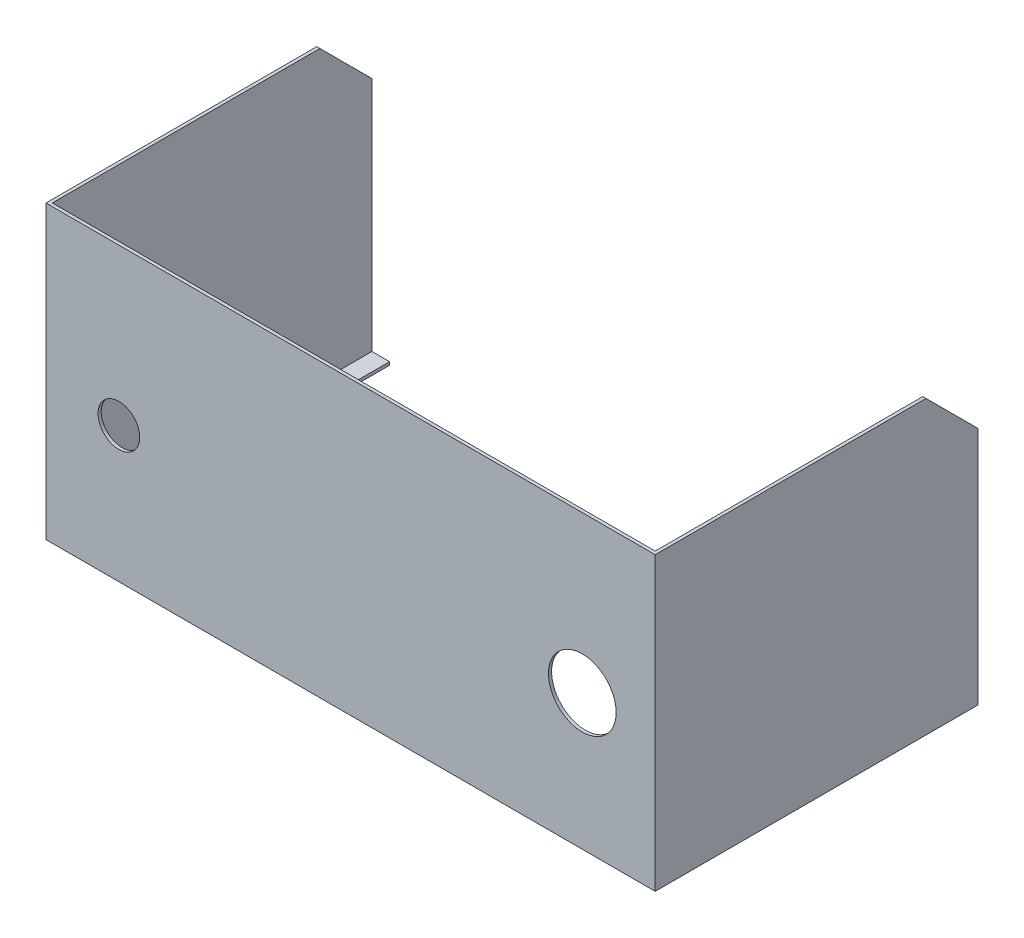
SolidWorks part; units mm, degrees
ref_plane "前视基准面" through (0, 0, 0) normal (0, 0, 1) x (1, 0, 0)
ref_plane "上视基准面" through (0, 0, 0) normal (0, 1, 0) x (1, 0, 0)
ref_plane "右视基准面" through (0, 0, 0) normal (1, 0, 0) x (0, 0, -1)
sketch "草图1" plane through (0, 0, 0) normal (0, 0, 1) x (1, 0, 0)
  line L1 (292.5, 140) -> (-292.5, 140)
  line L2 (292.5, 140) -> (292.5, -140)
  line L3 (292.5, -140) -> (-292.5, -140)
  line L4 (-292.5, 140) -> (-292.5, -140)
  line L5 (292.5, 140) -> (-292.5, -140) construction
  line L6 (292.5, -140) -> (-292.5, 140) construction
  circle A0 centre (-222.5, -10) radius 20
  circle A1 centre (222.5, -10) radius 32.5
  point P0 (0, 0)
  dimension "D3" = 70
  dimension "D1" = 585
  dimension "D2" = 280
  dimension "D4" = 130
  dimension "D5" = 70
  dimension "D6" = 130
extrude "凸台-拉伸1" add sketch "草图1" along normal blind 3
sketch "草图2" plane through (292.5, 0, 0) normal (1, 0, 0) x (0, 0, -1)
  line L0 (0, -140) -> (0, 140) construction
  line L1 (0, -140) -> (0, 140)
  line L2 (0, -140) -> (307, -140)
  line L3 (0, 140) -> (257, 140)
  line L4 (307, -140) -> (307, 90)
  line L5 (257, 140) -> (307, 90)
extrude "凸台-拉伸2" add sketch "草图2" against normal blind 3
sketch "草图3" plane through (-292.5, 0, 0) normal (-1, 0, 0) x (0, 0, 1)
  line L5 (-307, -140) -> (0, -140)
  line L6 (0, -140) -> (0, 140)
  line L7 (0, 140) -> (-257, 140)
  line L8 (-257, 140) -> (-307, 90)
  line L9 (-307, 90) -> (-307, -140)
  line L10 (-307, -140) -> (0, -140)
  line L11 (0, -140) -> (0, 140)
  line L12 (0, 140) -> (-257, 140)
  line L13 (-257, 140) -> (-307, 90)
  line L14 (-307, 90) -> (-307, -140)
  dimension "D1" = 0
extrude "凸台-拉伸3" add sketch "草图3" against normal blind 3
sketch "草图4" plane through (0, -140, 0) normal (0, -1, 0) x (1, 0, 0)
  line L0 (-289.5, -307) -> (-289.5, 0) construction
  line L1 (-289.5, 0) -> (289.5, 0) construction
  line L2 (289.5, 0) -> (289.5, -307) construction
  line L3 (-289.5, -307) -> (-289.5, 0)
  line L4 (-289.5, 0) -> (289.5, 0)
  line L5 (289.5, 0) -> (289.5, -307)
  line L6 (289.5, -307) -> (272.5, -307)
  line L7 (-289.5, -307) -> (-272.5, -307)
  line L8 (-272.5, -307) -> (-272.5, -17)
  line L9 (272.5, -307) -> (272.5, -17)
  line L10 (272.5, -17) -> (-272.5, -17)
extrude "凸台-拉伸4" add sketch "草图4" against normal blind 3 contours L10 L9 L6 L7 L8 M5 M4 M3
sketch "草图5" plane through (0, -140, 0) normal (0, -1, 0) x (1, 0, 0)
  line L0 (-272.5, -307) -> (-272.5, -17) construction
  line L1 (272.5, -307) -> (272.5, -17) construction
  line L2 (272.5, -17) -> (-272.5, -17) construction
  line L3 (-292.5, 3) -> (-292.5, -307) construction
  line L4 (292.5, 3) -> (292.5, -307) construction
  line L5 (-292.5, 3) -> (292.5, 3) construction
  circle A0 centre (280.5, -232) radius 1.75
  circle A1 centre (280.5, -92) radius 1.75
  circle A2 centre (137.5, -9) radius 1.75
  circle A3 centre (0, -9) radius 1.75
  circle A4 centre (-137.5, -9) radius 1.75
  circle A5 centre (-280.5, -232) radius 1.75
  circle A6 centre (-280.5, -92) radius 1.75
  dimension "D1" = 8
  dimension "D2" = 8
  dimension "D3" = 8
  dimension "D4" = 8
  dimension "D5" = 8
  dimension "D6" = 8
  dimension "D7" = 8
  dimension "D8" = 155
  dimension "D9" = 155
  dimension "D10" = 95
  dimension "D11" = 140
  dimension "D12" = 95
  dimension "D13" = 140
extrude "切除-拉伸1" cut sketch "草图5" against normal blind 3
